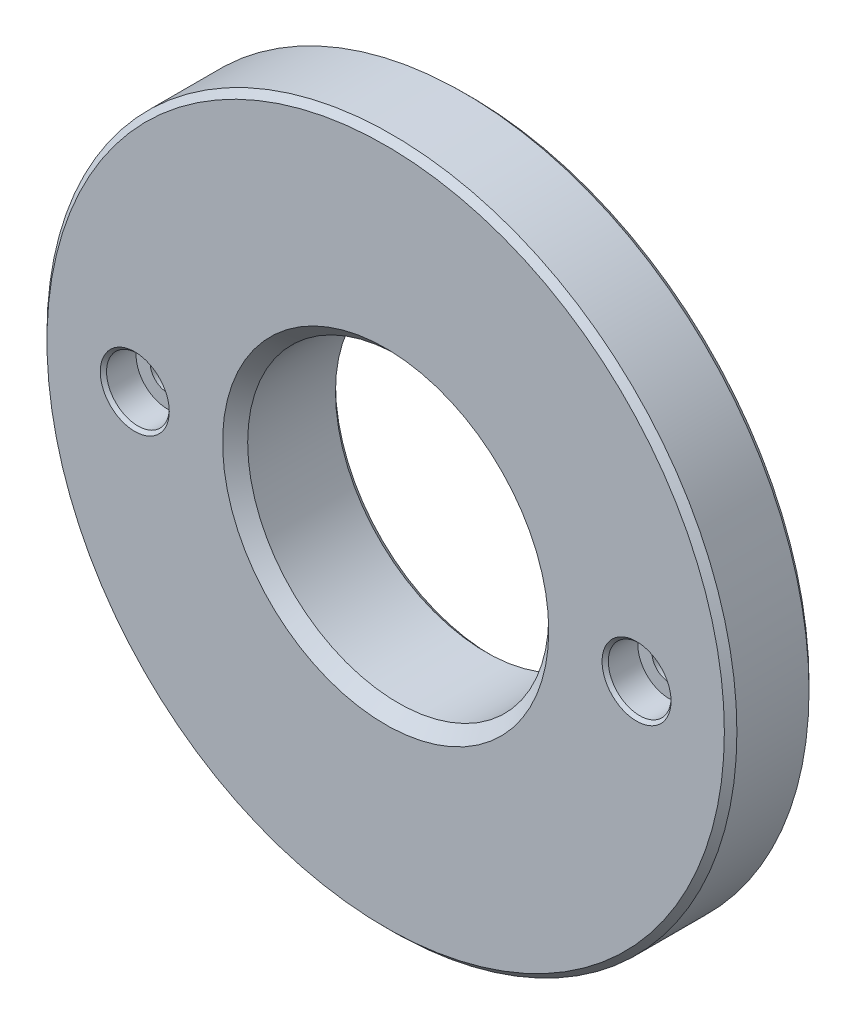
SolidWorks part; units mm, degrees
ref_plane "Face" through (0, 0, 0) normal (0, 0, 1) x (1, 0, 0)
ref_plane "Dessus" through (0, 0, 0) normal (0, 1, 0) x (1, 0, 0)
ref_plane "Droite" through (0, 0, 0) normal (1, 0, 0) x (0, 0, -1)
sketch "Esquisse2" plane through (0, 0, 0) normal (0, 0, 1) x (1, 0, 0)
  circle A0 centre (0, 0) radius 55
  dimension "D1" = 110
extrude "Extrusion1" add sketch "Esquisse2" against normal blind 13.5
chamfer "Chanfrein1" distance 1 angle 45 1 edges at (55, 0, 0)
chamfer "Chanfrein3" distance 1 angle 45 1 edges at (55, 0, -13.5)
sketch "Esquisse6" plane through (0, 0, 0) normal (0, 0, 1) x (1, 0, 0)
  line L0 (-63.2877, 0) -> (60.8904, 0) construction
  circle A0 centre (-40, 0) radius 5
  circle A1 centre (40, 0) radius 5
  dimension "D2" = 10
  dimension "D3" = 40
  dimension "D1" = 40
extrude "Enlèv. mat.-Extru.2" cut sketch "Esquisse6" against normal blind 5.2
sketch "Esquisse8" plane through (0, 0, -13.5) normal (0, 0, -1) x (-1, 0, 0)
  circle A0 centre (0, 0) radius 45
  dimension "D1" = 90
extrude "Extrusion2" add sketch "Esquisse8" along normal blind 3.5
chamfer "Chanfrein6" distance 1 angle 45 1 edges at (-45, 0, -17)
sketch "Esquisse9" plane through (0, 0, 0) normal (0, 0, 1) x (1, 0, 0)
  circle A0 centre (0, 0) radius 24
  dimension "D1" = 48
extrude "Extrusion3" cut sketch "Esquisse9" against normal blind 20
chamfer "Chanfrein7" distance 2 angle 45 1 edges at (24, 0, 0)
chamfer "Chanfrein8" distance 1 angle 45 1 edges at (-24, 0, -17)
sketch "Esquisse10" plane through (0, 0, 0) normal (0, 0, 1) x (1, 0, 0)
  circle A0 centre (-40, 0) radius 2.75
  circle A1 centre (40, 0) radius 2.75
  dimension "D1" = 5.5
  dimension "D2" = 5.5
extrude "Extrusion4" cut sketch "Esquisse10" against normal through all
chamfer "Chanfrein9" distance 0.5 angle 45 2 edges at (-35, 0, 0) (45, 0, 0)
